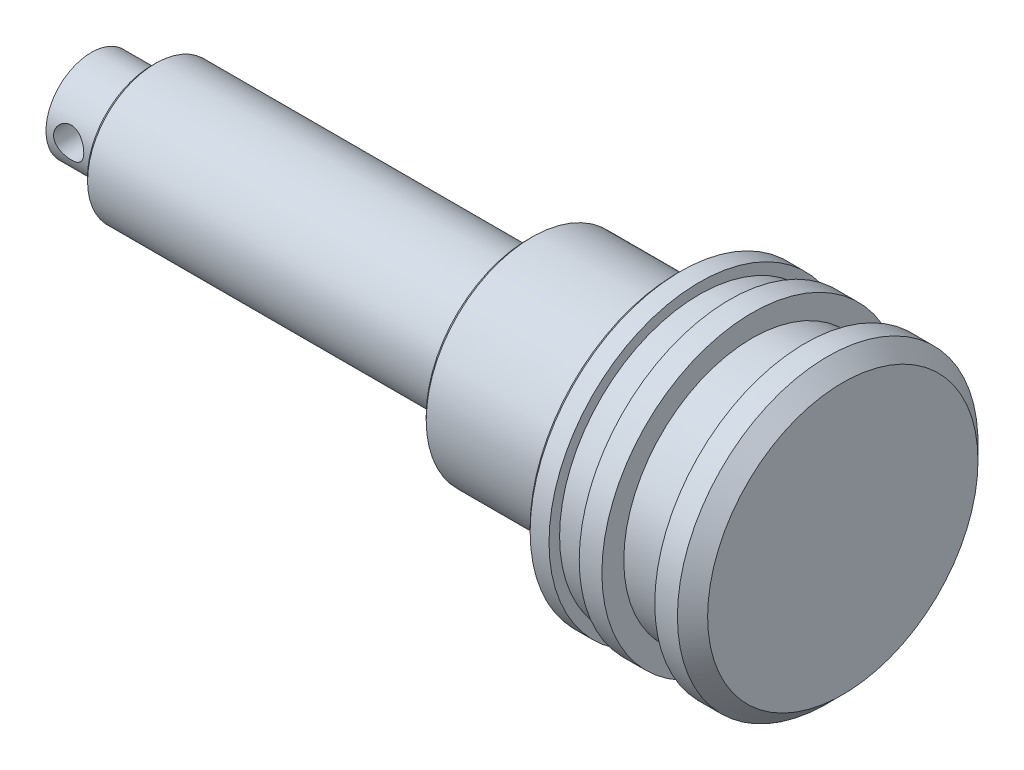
SolidWorks part; units mm, degrees
ref_plane "Face" through (0, 0, 0) normal (0, 0, 1) x (1, 0, 0)
ref_plane "Dessus" through (0, 0, 0) normal (0, 1, 0) x (1, 0, 0)
ref_plane "Droite" through (0, 0, 0) normal (1, 0, 0) x (0, 0, -1)
sketch "Esquisse1" plane through (0, 0, 0) normal (0, 0, 1) x (1, 0, 0)
  line L0 (0, 0) -> (112.8505, 0) construction
  line L1 (0, 0) -> (0, 17.9)
  line L2 (0, 17.9) -> (-2, 19.9)
  line L3 (-2, 19.9) -> (-5, 19.9)
  line L4 (-5, 19.9) -> (-5, 17)
  line L5 (-5, 17) -> (-12, 17)
  line L6 (-12, 17) -> (-12, 19.9)
  line L7 (-12, 19.9) -> (-15, 19.9)
  line L8 (-15, 19.9) -> (-15, 18.5)
  line L9 (-15, 18.5) -> (-19, 18.5)
  line L10 (-19, 18.5) -> (-19, 19.9)
  line L11 (-19, 19.9) -> (-21.5, 19.9)
  line L12 (-22, 19.4) -> (-22, 14)
  line L13 (-22, 14) -> (-41.16, 14)
  line L14 (-41.66, 13.5) -> (-41.66, 9)
  line L15 (-41.66, 9) -> (-91, 9)
  line L16 (-91.5, 8.5) -> (-91.5, 6)
  line L17 (-91.5, 6) -> (-99.5, 6)
  line L18 (-102, 0) -> (-99.5, 6)
  line L19 (-102, 0) -> (0, 0)
  line L20 (-21.5, 19.9) -> (-22, 19.4)
  line L21 (-41.16, 14) -> (-41.66, 13.5)
  line L22 (-91, 9) -> (-91.5, 8.5)
  point P15 (-22, 19.9)
  point P17 (-41.66, 14)
  point P19 (-91.5, 9)
  dimension "D1" = 7
  dimension "D2" = 39.8
  dimension "D3" = 5
  dimension "D4" = 2
  dimension "D5" = 45
  dimension "D6" = 34
  dimension "D7" = 37
  dimension "D8" = 4
  dimension "D9" = 22
  dimension "D10" = 28
  dimension "D11" = 41.66
  dimension "D12" = 18
  dimension "D13" = 91.5
  dimension "D14" = 8
  dimension "D15" = 3
  dimension "D16" = 12
  dimension "D17" = 102
  dimension "D20" = 0.5
  dimension "D21" = 0.5
  dimension "D18" = 0.5
  dimension "D19" = 45
revolve "Révolution1" add sketch "Esquisse1" angle 360 about L0
sketch "Esquisse2" plane through (0, 0, 0) normal (0, 0, 1) x (1, 0, 0)
  circle A0 centre (-96.5, 0) radius 2
  dimension "D1" = 4
  dimension "D2" = 96.5
extrude "Enlèv. mat.-Extru.1" cut sketch "Esquisse2" along normal through all and the other way through all
